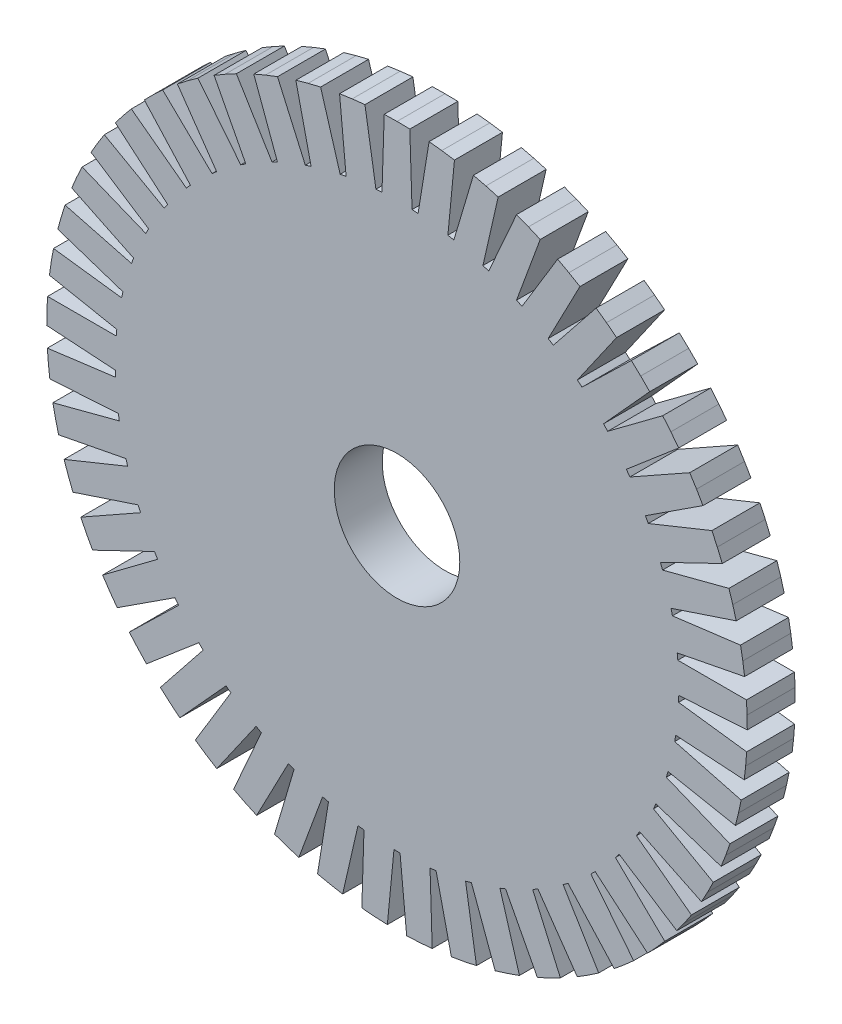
SolidWorks part; units mm, degrees
ref_plane "Front Plane" through (0, 0, 0) normal (0, 0, 1) x (1, 0, 0)
ref_plane "Top Plane" through (0, 0, 0) normal (0, 1, 0) x (1, 0, 0)
ref_plane "Right Plane" through (0, 0, 0) normal (1, 0, 0) x (0, 0, -1)
sketch "Sketch2" plane through (0, 0, 0) normal (0, 0, 1) x (1, 0, 0)
  line L1 (0, 21.9) -> (-0.7999, 21.8854)
  line L2 (0, 21.9) -> (0.7999, 21.8854)
  line L5 (0.9397, 17.5949) -> (0.7999, 21.8854)
  line L6 (-0.7999, 21.8854) -> (-0.9397, 17.5949)
  line L7 (3.1819, 17.3303) -> (3.5919, 21.6034)
  line L8 (2.0053, 21.808) -> (1.318, 17.5706)
  line L9 (2.8005, 21.7202) -> (3.5919, 21.6034)
  line L10 (2.8005, 21.7202) -> (2.0053, 21.808)
  line L11 (5.372, 16.7811) -> (6.325, 20.9667)
  line L12 (4.7776, 21.3725) -> (3.5541, 17.2578)
  line L13 (5.555, 21.1838) -> (6.325, 20.9667)
  line L14 (5.555, 21.1838) -> (4.7776, 21.3725)
  line L15 (7.4738, 15.9564) -> (8.9543, 19.9858)
  line L16 (7.4715, 20.5861) -> (5.7318, 16.6617)
  line L17 (8.2183, 20.2995) -> (8.9543, 19.9858)
  line L18 (8.2183, 20.2995) -> (7.4715, 20.5861)
  line L19 (9.4529, 14.8697) -> (11.4365, 18.6766)
  line L20 (10.0426, 19.4617) -> (7.8154, 15.7919)
  line L21 (10.7467, 19.0819) -> (11.4365, 18.6766)
  line L22 (10.7467, 19.0819) -> (10.0426, 19.4617)
  line L23 (11.2768, 13.5388) -> (13.7309, 17.0608)
  line L24 (12.4489, 18.0177) -> (9.7706, 14.6628)
  line L25 (13.0986, 17.551) -> (13.7309, 17.0608)
  line L26 (13.0986, 17.551) -> (12.4489, 18.0177)
  line L27 (12.9155, 11.9856) -> (15.7999, 15.1649)
  line L28 (14.6507, 16.2778) -> (11.5655, 13.293)
  line L29 (15.2354, 15.7319) -> (15.7999, 15.1649)
  line L30 (15.2354, 15.7319) -> (14.6507, 16.2778)
  line L31 (14.3421, 10.2356) -> (17.6094, 13.02)
  line L32 (16.612, 14.2707) -> (13.1704, 11.7049)
  line L33 (17.1221, 13.6544) -> (17.6094, 13.02)
  line L34 (17.1221, 13.6544) -> (16.612, 14.2707)
  line L35 (15.5333, 8.3175) -> (19.1298, 10.6612)
  line L36 (18.3005, 12.0292) -> (14.5591, 9.9246)
  line L37 (18.7276, 11.3528) -> (19.1298, 10.6612)
  line L38 (18.7276, 11.3528) -> (18.3005, 12.0292)
  line L39 (16.4694, 6.2629) -> (20.336, 8.1274)
  line L40 (19.6885, 9.5902) -> (15.7087, 7.9814)
  line L41 (20.0256, 8.8648) -> (20.336, 8.1274)
  line L42 (20.0256, 8.8648) -> (19.6885, 9.5902)
  line L43 (17.1351, 4.1054) -> (21.2084, 5.4602)
  line L44 (20.7532, 6.9938) -> (16.6003, 5.9071)
  line L45 (20.9948, 6.2312) -> (21.2084, 5.4602)
  line L46 (20.9948, 6.2312) -> (20.7532, 6.9938)
  line L47 (17.5194, 1.8805) -> (21.7325, 2.7033)
  line L48 (21.4772, 4.2825) -> (17.2194, 3.7358)
  line L49 (21.6193, 3.4952) -> (21.7325, 2.7033)
  line L50 (21.6193, 3.4952) -> (21.4772, 4.2825)
  line L51 (17.616, -0.3752) -> (21.8998, -0.098)
  line L52 (21.8485, 1.5009) -> (17.5558, 1.5031)
  line L53 (21.8887, 0.7019) -> (21.8998, -0.098)
  line L54 (21.8887, 0.7019) -> (21.8485, 1.5009)
  line L55 (17.4234, -2.6248) -> (21.7075, -2.8977)
  line L56 (21.8611, -1.3053) -> (17.6039, -0.7542)
  line L57 (21.7988, -2.1029) -> (21.7075, -2.8977)
  line L58 (21.7988, -2.1029) -> (21.8611, -1.3053)
  line L59 (16.9447, -4.8313) -> (21.1587, -5.6498)
  line L60 (21.5147, -4.0901) -> (17.3629, -2.9991)
  line L61 (21.3509, -4.8732) -> (21.1587, -5.6498)
  line L62 (21.3509, -4.8732) -> (21.5147, -4.0901)
  line L63 (16.1878, -6.9585) -> (20.2625, -8.3091)
  line L64 (20.815, -6.8078) -> (16.8368, -5.1948)
  line L65 (20.5525, -7.5635) -> (20.2625, -8.3091)
  line L66 (20.5525, -7.5635) -> (20.815, -6.8078)
  line L67 (15.165, -8.9714) -> (19.0336, -10.832)
  line L68 (19.7735, -9.4137) -> (16.0343, -7.3052)
  line L69 (19.4165, -10.1296) -> (19.0336, -10.832)
  line L70 (19.4165, -10.1296) -> (19.7735, -9.4137)
  line L71 (13.8933, -10.837) -> (17.4922, -13.177)
  line L72 (18.4074, -11.865) -> (14.9685, -9.2957)
  line L73 (17.9618, -12.5294) -> (17.4922, -13.177)
  line L74 (17.9618, -12.5294) -> (18.4074, -11.865)
  line L75 (12.3934, -12.5247) -> (15.6635, -15.3057)
  line L76 (16.739, -14.1214) -> (13.6569, -11.1335)
  line L77 (16.2121, -14.7234) -> (15.6635, -15.3057)
  line L78 (16.2121, -14.7234) -> (16.739, -14.1214)
  line L79 (10.69, -14.0067) -> (13.5777, -17.183)
  line L80 (14.7958, -16.146) -> (12.121, -12.7885)
  line L81 (14.1962, -16.6757) -> (13.5777, -17.183)
  line L82 (14.1962, -16.6757) -> (14.7958, -16.146)
  line L83 (8.8111, -15.2587) -> (11.2689, -18.7782)
  line L84 (12.6096, -17.9055) -> (10.3862, -14.2335)
  line L85 (11.9472, -18.3541) -> (11.2689, -18.7782)
  line L86 (11.9472, -18.3541) -> (12.6096, -17.9055)
  line L87 (6.7875, -16.2602) -> (8.7751, -20.0651)
  line L88 (10.2164, -19.371) -> (8.4808, -15.4448)
  line L89 (9.5021, -19.7312) -> (8.7751, -20.0651)
  line L90 (9.5021, -19.7312) -> (10.2164, -19.371)
  line L91 (4.6525, -16.9947) -> (6.1371, -21.0225)
  line L92 (7.6554, -20.5184) -> (6.4361, -16.4025)
  line L93 (6.9009, -20.7843) -> (6.1371, -21.0225)
  line L94 (6.9009, -20.7843) -> (7.6554, -20.5184)
  line L95 (2.4411, -17.4501) -> (3.3985, -21.6347)
  line L96 (4.9687, -21.3289) -> (4.2858, -17.0908)
  line L97 (4.1864, -21.4961) -> (3.3985, -21.6347)
  line L98 (4.1864, -21.4961) -> (4.9687, -21.3289)
  line L99 (0.1896, -17.619) -> (0.604, -21.8917)
  line L100 (2.2004, -21.7892) -> (2.065, -17.4986)
  line L101 (1.4031, -21.855) -> (0.604, -21.8917)
  line L102 (1.4031, -21.855) -> (2.2004, -21.7892)
  line L103 (-2.065, -17.4986) -> (-2.2004, -21.7892)
  line L104 (-0.604, -21.8917) -> (-0.1896, -17.619)
  line L105 (-1.4031, -21.855) -> (-2.2004, -21.7892)
  line L106 (-1.4031, -21.855) -> (-0.604, -21.8917)
  line L107 (-4.2858, -17.0908) -> (-4.9687, -21.3289)
  line L108 (-3.3985, -21.6347) -> (-2.4411, -17.4501)
  line L109 (-4.1864, -21.4961) -> (-4.9687, -21.3289)
  line L110 (-4.1864, -21.4961) -> (-3.3985, -21.6347)
  line L111 (-6.4361, -16.4025) -> (-7.6554, -20.5184)
  line L112 (-6.1371, -21.0225) -> (-4.6525, -16.9947)
  line L113 (-6.9009, -20.7843) -> (-7.6554, -20.5184)
  line L114 (-6.9009, -20.7843) -> (-6.1371, -21.0225)
  line L115 (-8.4808, -15.4448) -> (-10.2164, -19.371)
  line L116 (-8.7751, -20.0651) -> (-6.7875, -16.2602)
  line L117 (-9.5021, -19.7312) -> (-10.2164, -19.371)
  line L118 (-9.5021, -19.7312) -> (-8.7751, -20.0651)
  line L119 (-10.3862, -14.2335) -> (-12.6096, -17.9055)
  line L120 (-11.2689, -18.7782) -> (-8.8111, -15.2587)
  line L121 (-11.9472, -18.3541) -> (-12.6096, -17.9055)
  line L122 (-11.9472, -18.3541) -> (-11.2689, -18.7782)
  line L123 (-12.121, -12.7885) -> (-14.7958, -16.146)
  line L124 (-13.5777, -17.183) -> (-10.69, -14.0067)
  line L125 (-14.1962, -16.6757) -> (-14.7958, -16.146)
  line L126 (-14.1962, -16.6757) -> (-13.5777, -17.183)
  line L127 (-13.6569, -11.1335) -> (-16.739, -14.1214)
  line L128 (-15.6635, -15.3057) -> (-12.3934, -12.5247)
  line L129 (-16.2121, -14.7234) -> (-16.739, -14.1214)
  line L130 (-16.2121, -14.7234) -> (-15.6635, -15.3057)
  line L131 (-14.9685, -9.2957) -> (-18.4074, -11.865)
  line L132 (-17.4922, -13.177) -> (-13.8933, -10.837)
  line L133 (-17.9618, -12.5294) -> (-18.4074, -11.865)
  line L134 (-17.9618, -12.5294) -> (-17.4922, -13.177)
  line L135 (-16.0343, -7.3052) -> (-19.7735, -9.4137)
  line L136 (-19.0336, -10.832) -> (-15.165, -8.9714)
  line L137 (-19.4165, -10.1296) -> (-19.7735, -9.4137)
  line L138 (-19.4165, -10.1296) -> (-19.0336, -10.832)
  line L139 (-16.8368, -5.1948) -> (-20.815, -6.8078)
  line L140 (-20.2625, -8.3091) -> (-16.1878, -6.9585)
  line L141 (-20.5525, -7.5635) -> (-20.815, -6.8078)
  line L142 (-20.5525, -7.5635) -> (-20.2625, -8.3091)
  line L143 (-17.3629, -2.9991) -> (-21.5147, -4.0901)
  line L144 (-21.1587, -5.6498) -> (-16.9447, -4.8313)
  line L145 (-21.3509, -4.8732) -> (-21.5147, -4.0901)
  line L146 (-21.3509, -4.8732) -> (-21.1587, -5.6498)
  line L147 (-17.6039, -0.7542) -> (-21.8611, -1.3053)
  line L148 (-21.7075, -2.8977) -> (-17.4234, -2.6248)
  line L149 (-21.7988, -2.1029) -> (-21.8611, -1.3053)
  line L150 (-21.7988, -2.1029) -> (-21.7075, -2.8977)
  line L151 (-17.5558, 1.5031) -> (-21.8485, 1.5009)
  line L152 (-21.8998, -0.098) -> (-17.616, -0.3752)
  line L153 (-21.8887, 0.7019) -> (-21.8485, 1.5009)
  line L154 (-21.8887, 0.7019) -> (-21.8998, -0.098)
  line L155 (-17.2194, 3.7358) -> (-21.4772, 4.2825)
  line L156 (-21.7325, 2.7033) -> (-17.5194, 1.8805)
  line L157 (-21.6193, 3.4952) -> (-21.4772, 4.2825)
  line L158 (-21.6193, 3.4952) -> (-21.7325, 2.7033)
  line L159 (-16.6003, 5.9071) -> (-20.7532, 6.9938)
  line L160 (-21.2084, 5.4602) -> (-17.1351, 4.1054)
  line L161 (-20.9948, 6.2312) -> (-20.7532, 6.9938)
  line L162 (-20.9948, 6.2312) -> (-21.2084, 5.4602)
  line L163 (-15.7087, 7.9814) -> (-19.6885, 9.5902)
  line L164 (-20.336, 8.1274) -> (-16.4694, 6.2629)
  line L165 (-20.0256, 8.8648) -> (-19.6885, 9.5902)
  line L166 (-20.0256, 8.8648) -> (-20.336, 8.1274)
  line L167 (-14.5591, 9.9246) -> (-18.3005, 12.0292)
  line L168 (-19.1298, 10.6612) -> (-15.5333, 8.3175)
  line L169 (-18.7276, 11.3528) -> (-18.3005, 12.0292)
  line L170 (-18.7276, 11.3528) -> (-19.1298, 10.6612)
  line L171 (-13.1704, 11.7049) -> (-16.612, 14.2707)
  line L172 (-17.6094, 13.02) -> (-14.3421, 10.2356)
  line L173 (-17.1221, 13.6544) -> (-16.612, 14.2707)
  line L174 (-17.1221, 13.6544) -> (-17.6094, 13.02)
  line L175 (-11.5655, 13.293) -> (-14.6507, 16.2778)
  line L176 (-15.7999, 15.1649) -> (-12.9155, 11.9856)
  line L177 (-15.2354, 15.7319) -> (-14.6507, 16.2778)
  line L178 (-15.2354, 15.7319) -> (-15.7999, 15.1649)
  line L179 (-9.7706, 14.6628) -> (-12.4489, 18.0177)
  line L180 (-13.7309, 17.0608) -> (-11.2768, 13.5388)
  line L181 (-13.0986, 17.551) -> (-12.4489, 18.0177)
  line L182 (-13.0986, 17.551) -> (-13.7309, 17.0608)
  line L183 (-7.8154, 15.7919) -> (-10.0426, 19.4617)
  line L184 (-11.4365, 18.6766) -> (-9.4529, 14.8697)
  line L185 (-10.7467, 19.0819) -> (-10.0426, 19.4617)
  line L186 (-10.7467, 19.0819) -> (-11.4365, 18.6766)
  line L187 (-5.7318, 16.6617) -> (-7.4715, 20.5861)
  line L188 (-8.9543, 19.9858) -> (-7.4738, 15.9564)
  line L189 (-8.2183, 20.2995) -> (-7.4715, 20.5861)
  line L190 (-8.2183, 20.2995) -> (-8.9543, 19.9858)
  line L191 (-3.5541, 17.2578) -> (-4.7776, 21.3725)
  line L192 (-6.325, 20.9667) -> (-5.372, 16.7811)
  line L193 (-5.555, 21.1838) -> (-4.7776, 21.3725)
  line L194 (-5.555, 21.1838) -> (-6.325, 20.9667)
  line L195 (-1.318, 17.5706) -> (-2.0053, 21.808)
  line L196 (-3.5919, 21.6034) -> (-3.1819, 17.3303)
  line L197 (-2.8005, 21.7202) -> (-2.0053, 21.808)
  line L198 (-2.8005, 21.7202) -> (-3.5919, 21.6034)
  arc A0 (-5.372, 16.7811) -> (-5.7318, 16.6617) centre (0, 0) ccw
  arc A1 (-3.1819, 17.3303) -> (-3.5541, 17.2578) centre (0, 0) ccw
  arc A2 (-7.4738, 15.9564) -> (-7.8154, 15.7919) centre (0, 0) ccw
  arc A3 (-9.4529, 14.8697) -> (-9.7706, 14.6628) centre (0, 0) ccw
  arc A4 (-11.2768, 13.5388) -> (-11.5655, 13.293) centre (0, 0) ccw
  arc A5 (-12.9155, 11.9856) -> (-13.1704, 11.7049) centre (0, 0) ccw
  arc A6 (-14.3421, 10.2356) -> (-14.5591, 9.9246) centre (0, 0) ccw
  arc A7 (-15.5333, 8.3175) -> (-15.7087, 7.9814) centre (0, 0) ccw
  arc A8 (-16.4694, 6.2629) -> (-16.6003, 5.9071) centre (0, 0) ccw
  arc A9 (-17.1351, 4.1054) -> (-17.2194, 3.7358) centre (0, 0) ccw
  arc A10 (-17.5194, 1.8805) -> (-17.5558, 1.5031) centre (0, 0) ccw
  arc A11 (-17.616, -0.3752) -> (-17.6039, -0.7542) centre (0, 0) ccw
  arc A12 (-17.4234, -2.6248) -> (-17.3629, -2.9991) centre (0, 0) ccw
  arc A13 (-0.9397, 17.5949) -> (-1.318, 17.5706) centre (0, 0) ccw
  arc A14 (1.318, 17.5706) -> (0.9397, 17.5949) centre (0, 0) ccw
  arc A15 (3.5541, 17.2578) -> (3.1819, 17.3303) centre (0, 0) ccw
  arc A16 (5.7318, 16.6617) -> (5.372, 16.7811) centre (0, 0) ccw
  arc A17 (7.8154, 15.7919) -> (7.4738, 15.9564) centre (0, 0) ccw
  arc A18 (9.7706, 14.6628) -> (9.4529, 14.8697) centre (0, 0) ccw
  arc A19 (11.5655, 13.293) -> (11.2768, 13.5388) centre (0, 0) ccw
  arc A20 (13.1704, 11.7049) -> (12.9155, 11.9856) centre (0, 0) ccw
  arc A21 (14.5591, 9.9246) -> (14.3421, 10.2356) centre (0, 0) ccw
  arc A22 (15.7087, 7.9814) -> (15.5333, 8.3175) centre (0, 0) ccw
  arc A23 (16.6003, 5.9071) -> (16.4694, 6.2629) centre (0, 0) ccw
  arc A24 (17.2194, 3.7358) -> (17.1351, 4.1054) centre (0, 0) ccw
  arc A25 (17.5558, 1.5031) -> (17.5194, 1.8805) centre (0, 0) ccw
  arc A26 (17.6039, -0.7542) -> (17.616, -0.3752) centre (0, 0) ccw
  arc A27 (17.3629, -2.9991) -> (17.4234, -2.6248) centre (0, 0) ccw
  arc A28 (16.8368, -5.1948) -> (16.9447, -4.8313) centre (0, 0) ccw
  arc A29 (16.0343, -7.3052) -> (16.1878, -6.9585) centre (0, 0) ccw
  arc A30 (14.9685, -9.2957) -> (15.165, -8.9714) centre (0, 0) ccw
  arc A31 (13.6569, -11.1335) -> (13.8933, -10.837) centre (0, 0) ccw
  arc A32 (12.121, -12.7885) -> (12.3934, -12.5247) centre (0, 0) ccw
  arc A33 (10.3862, -14.2335) -> (10.69, -14.0067) centre (0, 0) ccw
  arc A34 (8.4808, -15.4448) -> (8.8111, -15.2587) centre (0, 0) ccw
  arc A35 (-6.7875, -16.2602) -> (-6.4361, -16.4025) centre (0, 0) ccw
  arc A36 (-8.8111, -15.2587) -> (-8.4808, -15.4448) centre (0, 0) ccw
  arc A37 (-10.69, -14.0067) -> (-10.3862, -14.2335) centre (0, 0) ccw
  arc A38 (-12.3934, -12.5247) -> (-12.121, -12.7885) centre (0, 0) ccw
  arc A39 (-13.8933, -10.837) -> (-13.6569, -11.1335) centre (0, 0) ccw
  arc A40 (-4.6525, -16.9947) -> (-4.2858, -17.0908) centre (0, 0) ccw
  arc A41 (-2.4411, -17.4501) -> (-2.065, -17.4986) centre (0, 0) ccw
  arc A42 (-0.1896, -17.619) -> (0.1896, -17.619) centre (0, 0) ccw
  arc A43 (2.065, -17.4986) -> (2.4411, -17.4501) centre (0, 0) ccw
  arc A44 (4.2858, -17.0908) -> (4.6525, -16.9947) centre (0, 0) ccw
  arc A45 (6.4361, -16.4025) -> (6.7875, -16.2602) centre (0, 0) ccw
  arc A46 (-15.165, -8.9714) -> (-14.9685, -9.2957) centre (0, 0) ccw
  arc A47 (-16.1878, -6.9585) -> (-16.0343, -7.3052) centre (0, 0) ccw
  arc A48 (-16.9447, -4.8313) -> (-16.8368, -5.1948) centre (0, 0) ccw
  circle A49 centre (0, 0) radius 3.925
  point P253 (0, 0)
  dimension "D2" = 4.2905
  dimension "D4" = 0.7999
extrude "Boss-Extrude1" add sketch "Sketch2" along normal blind 3
